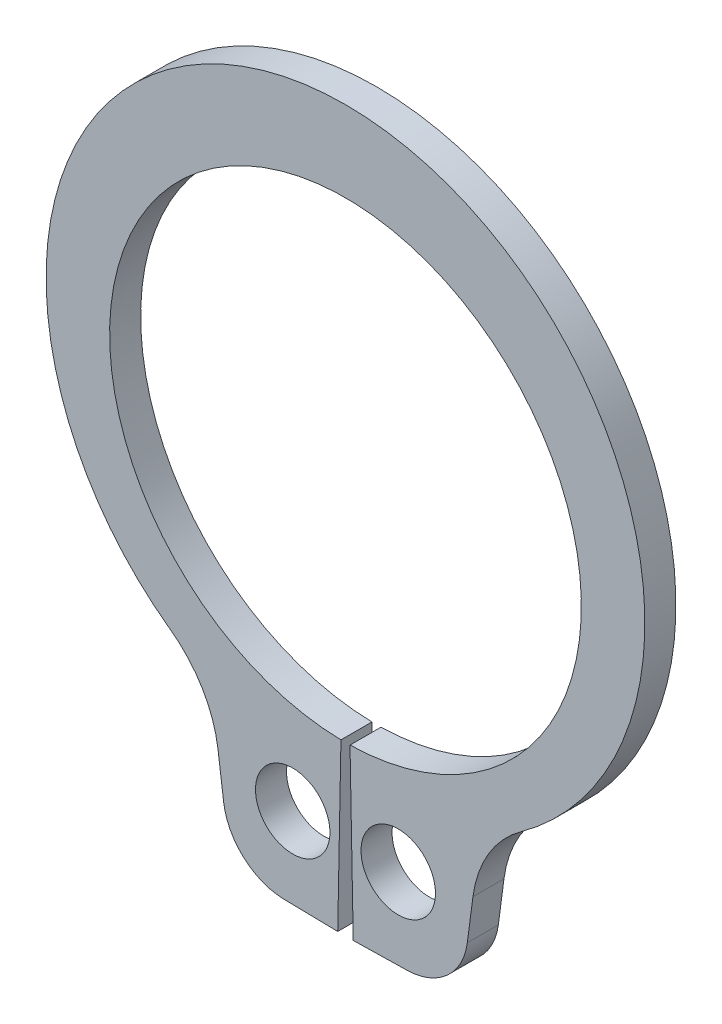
SolidWorks part; units mm, degrees
ref_plane "Plane1" through (0, 0, 0) normal (0, 0, 1) x (1, 0, 0)
ref_plane "Plane2" through (0, 0, 0) normal (0, 1, 0) x (1, 0, 0)
ref_plane "Plane3" through (0, 0, 0) normal (1, 0, 0) x (0, 0, -1)
sketch "Clipboard" plane through (0, 0, 0) normal (0, 0, 1) x (1, 0, 0)
  line L0 (0, 0) -> (0.65, 0)
  line L1 (0, 0) -> (0, 0.4)
  line L2 (0, 0) -> (0, -1.35)
  circle A0 centre (0, 0) radius 0.3
  circle A1 centre (0, 0) radius 2
  dimension "HoleDia" = 0.6
  dimension "ShaftDia" = 4
  dimension "LargeSection" = 0.65
  dimension "SmallSection" = 0.4
  dimension "LugSection" = 1.35
sketch "BodySke" plane through (0, 0, 0) normal (0, 0, 1) x (1, 0, 0)
  line L0 (-1.5431, 0) -> (1.5431, 0) construction
  line L1 (0, 0) -> (0, 2.55) construction
  line L2 (0.0365, -1.8996) -> (0.0625, -3.2494)
  line L3 (-0.0365, -1.8996) -> (-0.0625, -3.2494)
  line L4 (0, 0) -> (1.9681, -2.5863) construction
  line L5 (0, 0) -> (-1.9681, -2.5863) construction
  line L6 (0.0625, -3.2494) -> (0.4952, -3.2411)
  line L7 (1.0266, -2.4624) -> (0.9813, -2.8064)
  line L8 (-1.0266, -2.4624) -> (-0.9813, -2.8064)
  line L9 (-0.0625, -3.2494) -> (-0.4952, -3.2411)
  circle A0 centre (0, 0) radius 1.9 construction
  arc A1 (0.0365, -1.8996) -> (-0.0365, -1.8996) centre (0, 0) ccw
  arc A2 (1.3928, -1.8303) -> (-1.3928, -1.8303) centre (0, 0.1384) ccw construction
  arc A3 (0.0625, -3.2494) -> (0.8139, -3.1464) centre (0, 0) ccw construction
  arc A4 (1.4121, -1.8165) -> (1.0266, -2.4624) centre (1.9681, -2.5863) ccw
  arc A5 (-1.0266, -2.4624) -> (-1.4121, -1.8165) centre (-1.9681, -2.5863) ccw
  arc A6 (-0.8139, -3.1464) -> (-0.0625, -3.2494) centre (0, 0) ccw construction
  arc A7 (1.4121, -1.8165) -> (-1.4121, -1.8165) centre (0, 0.1384) ccw
  arc A8 (-1.0331, -2.4131) -> (1.0331, -2.4131) centre (0, 0) ccw construction
  circle A9 centre (0.425, -2.5904) radius 0.3
  circle A10 centre (-0.425, -2.5904) radius 0.3
  arc A11 (0.9813, -2.8064) -> (0.4952, -3.2411) centre (0.4856, -2.7412) cw
  arc A12 (-0.9813, -2.8064) -> (-0.4952, -3.2411) centre (-0.4856, -2.7412) ccw
  point P28 (0.9413, -3.1107)
  point P31 (-0.9413, -3.1107)
  dimension "GrooveDia" = 3.8
  dimension "D3" = 0.5
  dimension "LugRad" = 3.25
  dimension "HoleOffsetRad" = 2.625
  dimension "HoleDia" = 0.6
  dimension "D2" = 15
  dimension "LargeRad" = 2.55
  dimension "SmallRad" = 2.3
  dimension "Gap" = 0.125
  dimension "SmallAngle" = 74.54
  dimension "HoleSpacing" = 0.85
extrude "Body" add sketch "BodySke" against normal blind 0.25
equation "' \"ShaftDia@Clipboard\" = 4"
equation "' \"Thickness@Body\" = 0.25"
equation "' \"GrooveDia@BodySke\" = 3.8"
equation "' \"LugSection@Clipboard\" = 1.35"
equation "' \"LargeSection@Clipboard\" = 0.65"
equation "' \"SmallSection@Clipboard\" = 0.4"
equation "' \"HoleDia@Clipboard\" = 0.6"
equation "' \"ShaftDia@Clipboard\" = 15"
equation "' \"Thickness@Body\" = 0.9"
equation "' \"GrooveDia@BodySke\" = 14.15"
equation "' \"LugSection@Clipboard\" = 2.8"
equation "' \"LargeSection@Clipboard\" = 1.8"
equation "' \"SmallSection@Clipboard\" = 1.05"
equation "' \"HoleDia@Clipboard\" = 1.2"
equation "\"Gap@BodySke\" =  \"Thickness@Body\" / 2"
equation "\"LargeRad@BodySke\" =  \"GrooveDia@BodySke\" / 2 +  \"LargeSection@Clipboard\""
equation "\"SmallRad@BodySke\" =  \"GrooveDia@BodySke\" / 2 +  \"SmallSection@Clipboard\""
equation "\"LugRad@BodySke\" = \"GrooveDia@BodySke\" / 2 + \"LugSection@Clipboard\""
equation "\"HoleOffsetRad@BodySke\" = (  \"ShaftDia@Clipboard\" / 2 + \"LugRad@BodySke\" ) / 2"
equation "\"HoleSpacing@BodySke\" = \"Gap@BodySke\"  * 2 +  \"HoleDia@Clipboard\""
equation "\"HoleDia@BodySke\" =  \"HoleDia@Clipboard\""
equation "\"SmallAngle@BodySke\" = atn(\"HoleSpacing@BodySke\" / 2 / sqr(\"HoleOffsetRad@BodySke\"  * \"HoleOffsetRad@BodySke\" - (\"HoleSpacing@BodySke\" / 2) * (\"HoleSpacing@BodySke\" / 2) ))  * 8 * ( 180 / 3.141593)"
